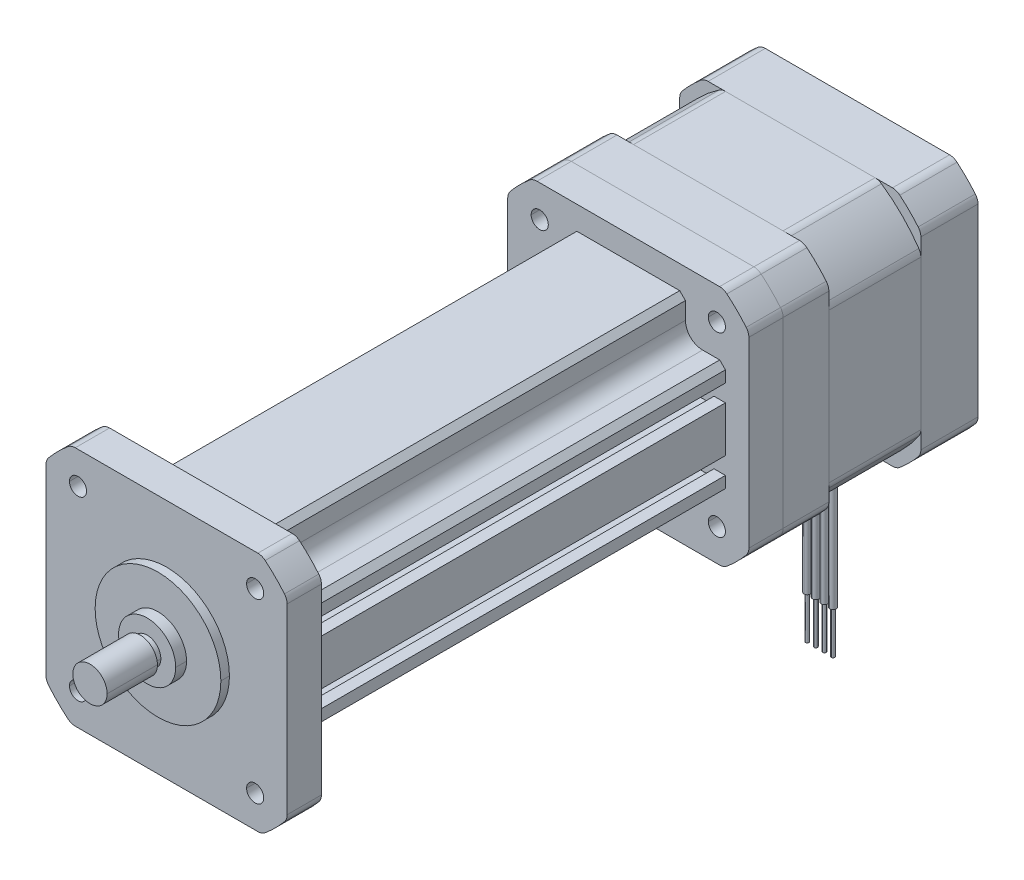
SolidWorks part; units mm, degrees
ref_plane "Front" through (0, 0, 0) normal (0, 0, 1) x (1, 0, 0)
ref_plane "Top" through (0, 0, 0) normal (0, 1, 0) x (1, 0, 0)
ref_plane "Right" through (0, 0, 0) normal (1, 0, 0) x (0, 0, -1)
imported_body "Imported1"
imported_body "Imported2"
imported_body "Imported3"
imported_body "Imported4"
imported_body "Imported5"
sketch "Sketch2" plane through (0, 0, 0) normal (1, 0, 0) x (0, 0, -1)
  line L0 (-30.4635, 38.4758) -> (-30.4635, -3.7242)
  line L2 (18.9365, 38.4758) -> (24.9365, 38.4758) construction
  line L3 (24.9365, -3.7242) -> (18.9365, -3.7242) construction
  line L4 (-30.4635, 33.3508) -> (-30.4635, 1.4008) construction
surface "Surface-Extrude1" sketch "Sketch2" parameters "D1"=100
split "Split1" trimming surface bodies 109 bodies to split 108 104 105 107 106 resulting bodies 110 111 112 113 114 115
move or copy body "Body-Move/Copy1" bodies to move or copy 114 placed by mates yes parameters "D1"=0, "D2"=0, "D3"=0
other "Distance1" parameters "D1"=74.8
sketch "Sketch3" plane through (0, 0, 30.4635) normal (0, 0, 1) x (1, 0, 0)
  line L52 (-58.99, 27.3758) -> (-61.99, 27.3758)
  line L53 (-61.99, 27.3758) -> (-62.99, 26.3758)
  line L54 (-62.99, 26.3758) -> (-62.99, 24.3758)
  line L55 (-62.99, 24.3758) -> (-60.99, 24.3758)
  line L56 (-60.99, 24.3758) -> (-60.99, 25.7258)
  line L57 (-60.99, 25.7258) -> (-58.49, 25.7258)
  line L58 (-58.49, 25.7258) -> (-58.49, 20.0258)
  line L59 (-58.49, 20.0258) -> (-60.99, 20.0258)
  line L60 (-60.99, 20.0258) -> (-60.99, 21.3758)
  line L61 (-60.99, 21.3758) -> (-62.99, 21.3758)
  line L62 (-62.99, 21.3758) -> (-62.99, 13.3758)
  line L63 (-62.99, 13.3758) -> (-60.99, 13.3758)
  line L64 (-60.99, 13.3758) -> (-60.99, 14.7258)
  line L65 (-60.99, 14.7258) -> (-58.49, 14.7258)
  line L66 (-58.49, 14.7258) -> (-58.49, 9.0258)
  line L67 (-58.49, 9.0258) -> (-60.99, 9.0258)
  line L68 (-60.99, 9.0258) -> (-60.99, 10.3758)
  line L69 (-60.99, 10.3758) -> (-62.99, 10.3758)
  line L70 (-62.99, 10.3758) -> (-62.99, 8.3758)
  line L71 (-62.99, 8.3758) -> (-61.99, 7.3758)
  line L72 (-61.99, 7.3758) -> (-58.99, 7.3758)
  line L73 (-55.99, 4.3758) -> (-55.99, 1.3758)
  line L74 (-55.99, 1.3758) -> (-54.99, 0.3758)
  line L75 (-54.99, 0.3758) -> (-36.99, 0.3758)
  line L76 (-36.99, 0.3758) -> (-35.99, 1.3758)
  line L77 (-35.99, 1.3758) -> (-35.99, 4.3758)
  line L78 (-32.99, 7.3758) -> (-29.99, 7.3758)
  line L79 (-29.99, 7.3758) -> (-28.99, 8.3758)
  line L80 (-28.99, 8.3758) -> (-28.99, 10.3758)
  line L81 (-28.99, 10.3758) -> (-30.99, 10.3758)
  line L82 (-30.99, 10.3758) -> (-30.99, 9.0258)
  line L83 (-30.99, 9.0258) -> (-33.49, 9.0258)
  line L84 (-33.49, 9.0258) -> (-33.49, 14.7258)
  line L85 (-33.49, 14.7258) -> (-30.99, 14.7258)
  line L86 (-30.99, 14.7258) -> (-30.99, 13.3758)
  line L87 (-30.99, 13.3758) -> (-28.99, 13.3758)
  line L88 (-28.99, 13.3758) -> (-28.99, 21.3758)
  line L89 (-28.99, 21.3758) -> (-30.99, 21.3758)
  line L90 (-30.99, 21.3758) -> (-30.99, 20.0258)
  line L91 (-30.99, 20.0258) -> (-33.49, 20.0258)
  line L92 (-33.49, 20.0258) -> (-33.49, 25.7258)
  line L93 (-33.49, 25.7258) -> (-30.99, 25.7258)
  line L94 (-30.99, 25.7258) -> (-30.99, 24.3758)
  line L95 (-30.99, 24.3758) -> (-28.99, 24.3758)
  line L96 (-28.99, 24.3758) -> (-28.99, 26.3758)
  line L97 (-28.99, 26.3758) -> (-29.99, 27.3758)
  line L98 (-29.99, 27.3758) -> (-32.99, 27.3758)
  line L99 (-35.99, 30.3758) -> (-35.99, 33.3758)
  line L100 (-35.99, 33.3758) -> (-36.99, 34.3758)
  line L101 (-36.99, 34.3758) -> (-54.99, 34.3758)
  line L102 (-54.99, 34.3758) -> (-55.99, 33.3758)
  line L103 (-55.99, 33.3758) -> (-55.99, 30.3758)
  line L104 (-58.99, 27.3758) -> (-61.99, 27.3758)
  line L105 (-61.99, 27.3758) -> (-62.99, 26.3758)
  line L106 (-62.99, 26.3758) -> (-62.99, 24.3758)
  line L107 (-62.99, 24.3758) -> (-60.99, 24.3758)
  line L108 (-60.99, 24.3758) -> (-60.99, 25.7258)
  line L109 (-60.99, 25.7258) -> (-58.49, 25.7258)
  line L110 (-58.49, 25.7258) -> (-58.49, 20.0258)
  line L111 (-58.49, 20.0258) -> (-60.99, 20.0258)
  line L112 (-60.99, 20.0258) -> (-60.99, 21.3758)
  line L113 (-60.99, 21.3758) -> (-62.99, 21.3758)
  line L114 (-62.99, 21.3758) -> (-62.99, 13.3758)
  line L115 (-62.99, 13.3758) -> (-60.99, 13.3758)
  line L116 (-60.99, 13.3758) -> (-60.99, 14.7258)
  line L117 (-60.99, 14.7258) -> (-58.49, 14.7258)
  line L118 (-58.49, 14.7258) -> (-58.49, 9.0258)
  line L119 (-58.49, 9.0258) -> (-60.99, 9.0258)
  line L120 (-60.99, 9.0258) -> (-60.99, 10.3758)
  line L121 (-60.99, 10.3758) -> (-62.99, 10.3758)
  line L122 (-62.99, 10.3758) -> (-62.99, 8.3758)
  line L123 (-62.99, 8.3758) -> (-61.99, 7.3758)
  line L124 (-61.99, 7.3758) -> (-58.99, 7.3758)
  line L125 (-55.99, 4.3758) -> (-55.99, 1.3758)
  line L126 (-55.99, 1.3758) -> (-54.99, 0.3758)
  line L127 (-54.99, 0.3758) -> (-36.99, 0.3758)
  line L128 (-36.99, 0.3758) -> (-35.99, 1.3758)
  line L129 (-35.99, 1.3758) -> (-35.99, 4.3758)
  line L130 (-32.99, 7.3758) -> (-29.99, 7.3758)
  line L131 (-29.99, 7.3758) -> (-28.99, 8.3758)
  line L132 (-28.99, 8.3758) -> (-28.99, 10.3758)
  line L133 (-28.99, 10.3758) -> (-30.99, 10.3758)
  line L134 (-30.99, 10.3758) -> (-30.99, 9.0258)
  line L135 (-30.99, 9.0258) -> (-33.49, 9.0258)
  line L136 (-33.49, 9.0258) -> (-33.49, 14.7258)
  line L137 (-33.49, 14.7258) -> (-30.99, 14.7258)
  line L138 (-30.99, 14.7258) -> (-30.99, 13.3758)
  line L139 (-30.99, 13.3758) -> (-28.99, 13.3758)
  line L140 (-28.99, 13.3758) -> (-28.99, 21.3758)
  line L141 (-28.99, 21.3758) -> (-30.99, 21.3758)
  line L142 (-30.99, 21.3758) -> (-30.99, 20.0258)
  line L143 (-30.99, 20.0258) -> (-33.49, 20.0258)
  line L144 (-33.49, 20.0258) -> (-33.49, 25.7258)
  line L145 (-33.49, 25.7258) -> (-30.99, 25.7258)
  line L146 (-30.99, 25.7258) -> (-30.99, 24.3758)
  line L147 (-30.99, 24.3758) -> (-28.99, 24.3758)
  line L148 (-28.99, 24.3758) -> (-28.99, 26.3758)
  line L149 (-28.99, 26.3758) -> (-29.99, 27.3758)
  line L150 (-29.99, 27.3758) -> (-32.99, 27.3758)
  line L151 (-35.99, 30.3758) -> (-35.99, 33.3758)
  line L152 (-35.99, 33.3758) -> (-36.99, 34.3758)
  line L153 (-36.99, 34.3758) -> (-54.99, 34.3758)
  line L154 (-54.99, 34.3758) -> (-55.99, 33.3758)
  line L155 (-55.99, 33.3758) -> (-55.99, 30.3758)
  arc A4 (-58.99, 27.3758) -> (-55.99, 30.3758) centre (-58.99, 30.3758) ccw
  arc A5 (-55.99, 4.3758) -> (-58.99, 7.3758) centre (-58.99, 4.3758) ccw
  arc A6 (-32.99, 7.3758) -> (-35.99, 4.3758) centre (-32.99, 4.3758) ccw
  arc A7 (-35.99, 30.3758) -> (-32.99, 27.3758) centre (-32.99, 30.3758) ccw
  arc A8 (-58.99, 27.3758) -> (-55.99, 30.3758) centre (-58.99, 30.3758) ccw
  arc A9 (-55.99, 4.3758) -> (-58.99, 7.3758) centre (-58.99, 4.3758) ccw
  arc A10 (-32.99, 7.3758) -> (-35.99, 4.3758) centre (-32.99, 4.3758) ccw
  arc A11 (-35.99, 30.3758) -> (-32.99, 27.3758) centre (-32.99, 30.3758) ccw
  dimension "D1" = 0
extrude "Boss-Extrude1" add sketch "Sketch3" along normal up to next
sketch "Sketch4" plane through (0, 0, 0) normal (1, 0, 0) x (0, 0, -1)
  line L0 (-63.3635, 28.3758) -> (-63.3635, 6.3758)
surface "Surface-Extrude2" sketch "Sketch4" parameters "D1"=90
split "Split2" [suppressed] bodies to split 115 112 117 110 111
move or copy body "Body-Move/Copy2" [suppressed] bodies to move or copy 122 copy no translate (0, 0, 4.5) parameters "D1"=0, "D2"=0, "D3"=4.5
sketch "Sketch5" [suppressed] plane through (0, 0, 67.8635) normal (0, 0, -1) x (-1, 0, 0)
  arc A2 (40.99, 17.3758) -> (50.99, 17.3758) centre (45.99, 17.3758) ccw
  arc A3 (50.99, 17.3758) -> (40.99, 17.3758) centre (45.99, 17.3758) ccw
  arc A4 (40.99, 17.3758) -> (50.99, 17.3758) centre (45.99, 17.3758) ccw
  arc A5 (50.99, 17.3758) -> (40.99, 17.3758) centre (45.99, 17.3758) ccw
  dimension "D1" = 0
extrude "Boss-Extrude2" [suppressed] add sketch "Sketch5" along normal up to next
